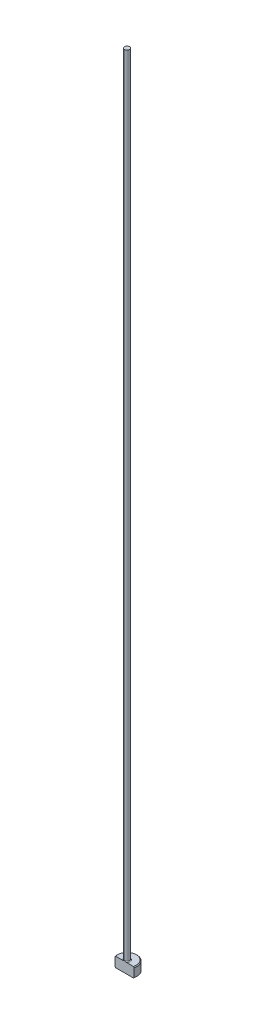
SolidWorks part; units mm, degrees
ref_plane "Front Plane" through (0, 0, 0) normal (0, 0, 1) x (1, 0, 0)
ref_plane "Top Plane" through (0, 0, 0) normal (0, 1, 0) x (1, 0, 0)
ref_plane "Right Plane" through (0, 0, 0) normal (1, 0, 0) x (0, 0, -1)
sketch "Sketch1" plane through (0, 0, 0) normal (0, 0, 1) x (1, 0, 0)
  line L0 (0, 259.9588) -> (0, -15.1925) construction
  line L1 (0, 0) -> (-3.175, 0)
  line L2 (-3.175, 0) -> (-3.175, 3.175)
  line L3 (-3.175, 3.175) -> (-0.7937, 3.175)
  line L4 (-0.7937, 3.175) -> (-0.7937, 254)
  line L5 (-0.7937, 254) -> (0, 254)
  line L6 (0, 254) -> (0, 0)
  dimension "L" = 254
  dimension "H" = 6.35
  dimension "T" = 3.175
  dimension "D" = 1.5875
revolve "Revolve1" add sketch "Sketch1" angle 360 about L0
chamfer "Chamfer1" distance 0.254 angle 45 2 edges at (0, 3.175, 3.175) (0, 0, 3.175)
fillet "Fillet1" radius 0.254 1 edges at (0, 3.175, 0.7937)
sketch "Sketch2" plane through (0, 0, 0) normal (0, 1, 0) x (1, 0, 0)
  line L0 (-3.0742, -0.7937) -> (3.0742, -0.7937)
  circle A0 centre (0, 0) radius 3.175 construction
  arc A1 (-3.0742, -0.7937) -> (3.0742, -0.7937) centre (0, 0) ccw
  circle A3 centre (0, 0) radius 0.7937 construction
  dimension "D1" = 0
extrude "Key" cut sketch "Sketch2" along normal through all
sketch "Pocket Sketch" plane through (0, 0, 0) normal (0, 0, 1) x (1, 0, 0)
  line L0 (-3.5719, 0) -> (-3.5719, 3.2004)
  line L1 (-3.5719, 3.2004) -> (-1.7542, 3.2004)
  line L2 (-0.9922, 3.9624) -> (-0.9922, 22.225)
  line L3 (-0.9922, 22.225) -> (0, 22.225)
  line L4 (0, 22.225) -> (0, 0)
  line L5 (0, 0) -> (-3.5719, 0)
  line L6 (0, 12.6104) -> (0, -2.4989) construction
  line L7 (-3.175, 2.921) -> (-3.175, 0.254) construction
  line L8 (2.921, 3.175) -> (-2.921, 3.175) construction
  line L9 (-0.7937, 254) -> (-0.7937, 3.429) construction
  line L10 (-1.7542, 3.2004) -> (-0.9922, 3.9624)
  point P3 (-0.9922, 3.2004)
  dimension "D1" = 7.1437
  dimension "D2" = 0.3969
  dimension "D3" = 0.0254
  dimension "D4" = 0.1984
  dimension "D5" = 1.9844
  dimension "D6" = 22.225
